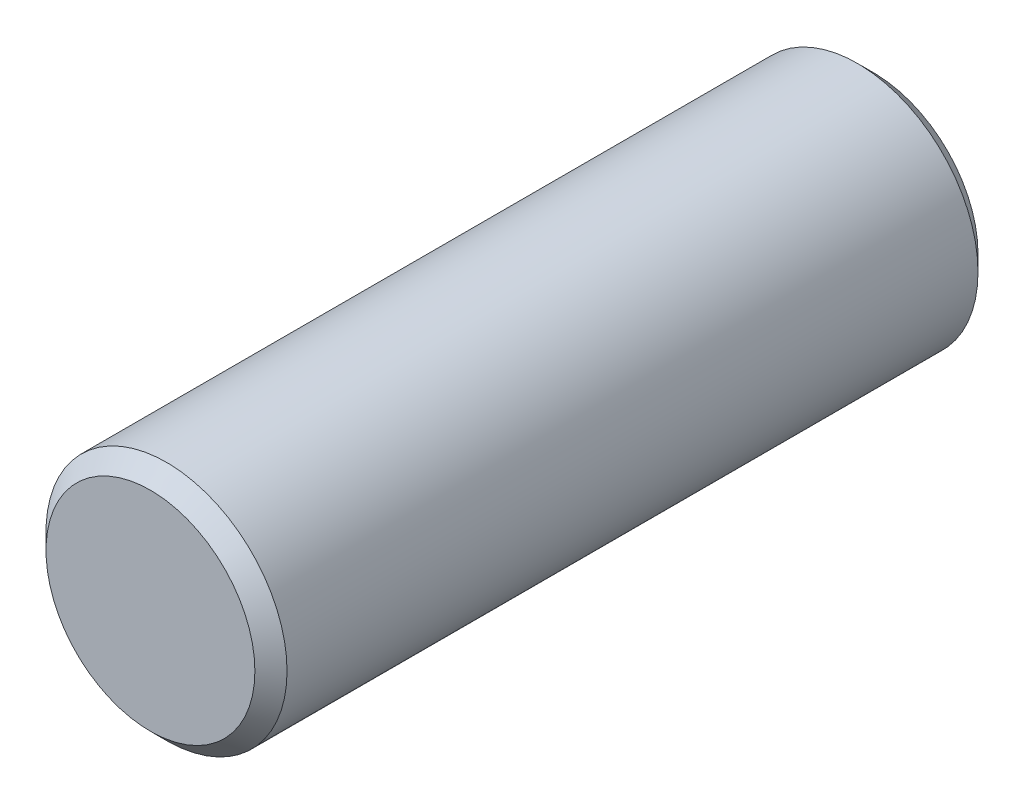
SolidWorks part; units mm, degrees
ref_plane "Plan de face" through (0, 0, 0) normal (0, 0, 1) x (1, 0, 0)
ref_plane "Plan de dessus" through (0, 0, 0) normal (0, 1, 0) x (1, 0, 0)
ref_plane "Plan de droite" through (0, 0, 0) normal (1, 0, 0) x (0, 0, -1)
sketch "Esquisse1" plane through (0, 0, 0) normal (0, 0, 1) x (1, 0, 0)
  circle A0 centre (0, 0) radius 1.5
  dimension "D1" = 3
extrude "Extrusion1" add sketch "Esquisse1" along normal blind 9
chamfer "Chanfrein1" distance 0.2 angle 45 2 edges at (1.5, 0, 0) (1.5, 0, 9)
